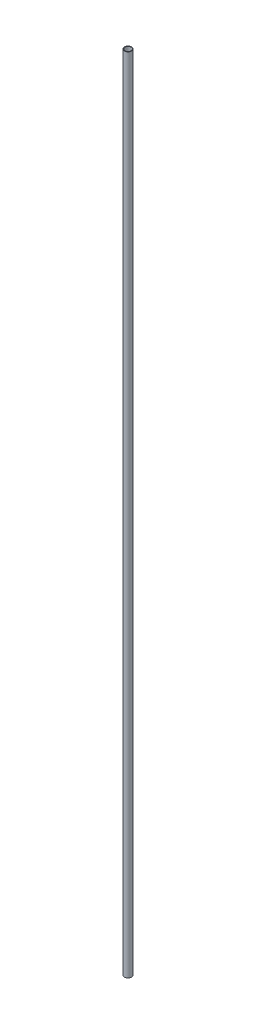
SolidWorks part; units mm, degrees
ref_plane "Front Plane" through (0, 0, 0) normal (0, 0, 1) x (1, 0, 0)
ref_plane "Top Plane" through (0, 0, 0) normal (0, 1, 0) x (1, 0, 0)
ref_plane "Right Plane" through (0, 0, 0) normal (1, 0, 0) x (0, 0, -1)
sketch "Sketch2" plane through (0, 0, 0) normal (0, 1, 0) x (1, 0, 0)
  circle A0 centre (0, 0) radius 9.525
  circle A1 centre (0, 0) radius 8.255
  dimension "D1" = 19.05
  dimension "D2" = 1.27
extrude "Boss-Extrude1" add sketch "Sketch2" along normal blind 2108.2
